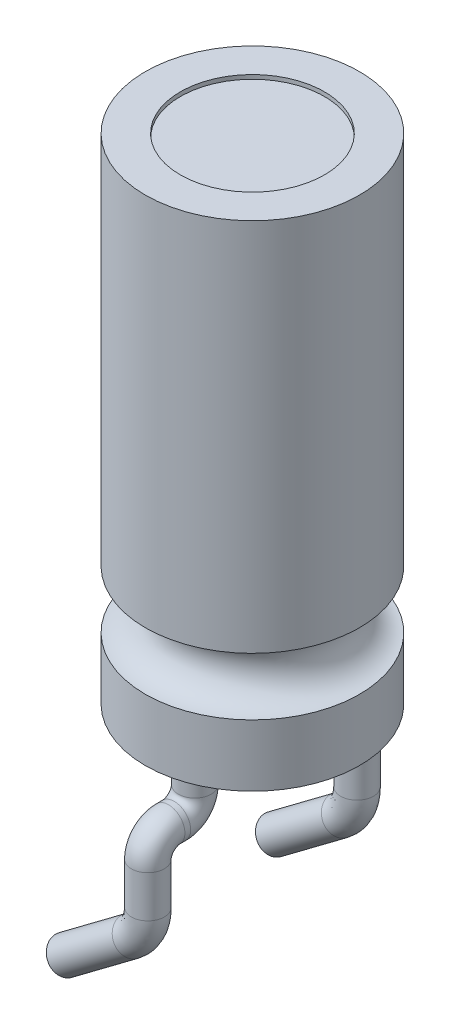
SolidWorks part; units mm, degrees
ref_plane "Face" through (0, 0, 0) normal (0, 0, 1) x (1, 0, 0)
ref_plane "Dessus" through (0, 0, 0) normal (0, 1, 0) x (1, 0, 0)
ref_plane "Droite" through (0, 0, 0) normal (1, 0, 0) x (0, 0, -1)
sketch "Esquisse1" plane through (0, 0, 0) normal (0, 0, 1) x (1, 0, 0)
  line L0 (0, 48.4017) -> (0, -33.7592) construction
  line L1 (0, 39.5164) -> (2.6, 39.5164)
  line L2 (2.6, 39.5164) -> (2.6, 30.4164)
  line L3 (2.6, 29.0164) -> (2.6, 27.5164)
  line L4 (2.6, 27.5164) -> (0, 27.5164)
  line L5 (0, 27.5164) -> (0, 39.5164)
  line L6 (9.8114, 29.7164) -> (-7.1309, 29.7164) construction
  line L7 (2.6, 25.0819) -> (2.6, 32.6721) construction
  line L8 (5.1241, 27.5164) -> (-5.6865, 27.5164) construction
  line L9 (5.1241, 29.0164) -> (-3.1767, 29.0164) construction
  arc A0 (2.6, 30.4164) -> (2.6, 29.0164) centre (2.6, 29.7164) ccw
  dimension "D4" = 0.7
  dimension "D1" = 12
  dimension "D2" = 2.6
  dimension "D3" = 1.5
revolve "Révolution1" add sketch "Esquisse1" angle 360 about L0
sketch "Esquisse2" plane through (0, 39.5164, 0) normal (0, 1, 0) x (-1, 0, 0)
  circle A0 centre (0, 0) radius 1.75
  dimension "D1" = 3.5
extrude "Enlèv. mat.-Extru.1" cut sketch "Esquisse2" against normal blind 0.1
sketch "Esquisse3" plane through (0, 27.5164, 0) normal (0, -1, 0) x (1, 0, 0)
  line L0 (4.0351, 0) -> (-4.283, 0) construction
  line L1 (0, 6.7464) -> (0, -6.9013) construction
  circle A0 centre (0, 1.4) radius 0.4
  dimension "D1" = 0.8
sketch "Esquisse4" plane through (0, 0, 0) normal (1, 0, 0) x (0, 0, -1)
  line L0 (-1.4, 24.8484) -> (-1.4, 29.3314) construction
  line L1 (-5.5325, 26.0164) -> (6.9013, 26.0164) construction
  line L2 (-2.54, 26.4376) -> (-2.54, 18.8472) construction
  line L3 (-8.7913, 27.5164) -> (10.5025, 27.5164) construction
  line L4 (0, 26.7733) -> (0, 22.2147) construction
  line L6 (-1.4, 27.5164) -> (-1.4, 26.5164)
  line L7 (-1.9, 26.0164) -> (-2.04, 26.0164)
  arc A0 (-1.4, 26.5164) -> (-1.9, 26.0164) centre (-1.9, 26.5164) cw
  arc A1 (-2.04, 26.0164) -> (-2.54, 25.5164) centre (-2.04, 25.5164) ccw
  dimension "D4" = 0.5
  dimension "D1" = 1.5
  dimension "D2" = 2.54
sweep "Balayage1" add profiles "Esquisse3" path "Esquisse4"
sketch "Esquisse5" plane through (0, 25.5164, 0) normal (0, -1, 0) x (1, 0, 0)
  line L0 (0, 2.8846) -> (0, 1.9) construction
  line L1 (0.1862, 2.54) -> (-0.4, 2.54) construction
  circle A0 centre (0, 2.54) radius 0.4
ref_plane "Plan1" through (0, 0, 2.54) normal (0, 0, 1) x (1, 0, 0)
sketch "Esquisse6" plane through (0, 0, 2.54) normal (0, 0, 1) x (1, 0, 0)
  line L0 (0, 25.7821) -> (0, 22.579) construction
  line L1 (1.0149, 23.5164) -> (-9.4986, 23.5164) construction
  line L2 (1.2934, 25.5164) -> (-9.4986, 25.5164) construction
  line L3 (-2.6, 27.2212) -> (-2.6, 21.8479) construction
  line L4 (-4.6, 18.4772) -> (-4.6, 27.2212) construction
  line L5 (0, 25.5164) -> (0.0006, 24.5036)
  line L6 (-4.7522, 20.4407) -> (1.2898, 24.9691) construction
  line L7 (-1.42, 24.5031) -> (0.6748, 24.5031) construction
  line L8 (-0.9994, 25.1152) -> (-0.9994, 19.8885) construction
  line L9 (-2.0001, 22.5034) -> (-0.3997, 23.7029)
  line L10 (0.8074, 18.7576) -> (-2.6988, 23.4357) construction
  line L11 (-0.3997, 23.7029) -> (0.4123, 22.6195) construction
  arc A0 (-0.3997, 23.7029) -> (0.0006, 24.5036) centre (-0.9994, 24.5031) ccw
  dimension "D3" = 90
  dimension "D1" = 2
  dimension "D2" = 2
  dimension "D4" = 2
ref_plane "Plan2" through (0, 0, 0) normal (0, 0, 1) x (1, 0, 0)
sweep "Balayage2" add profiles "Esquisse5" path "Esquisse6"
mirror "Symétrie1" about plane through (0, 0, 0) normal (0, 0, 1) of "Balayage2", "Balayage1"
